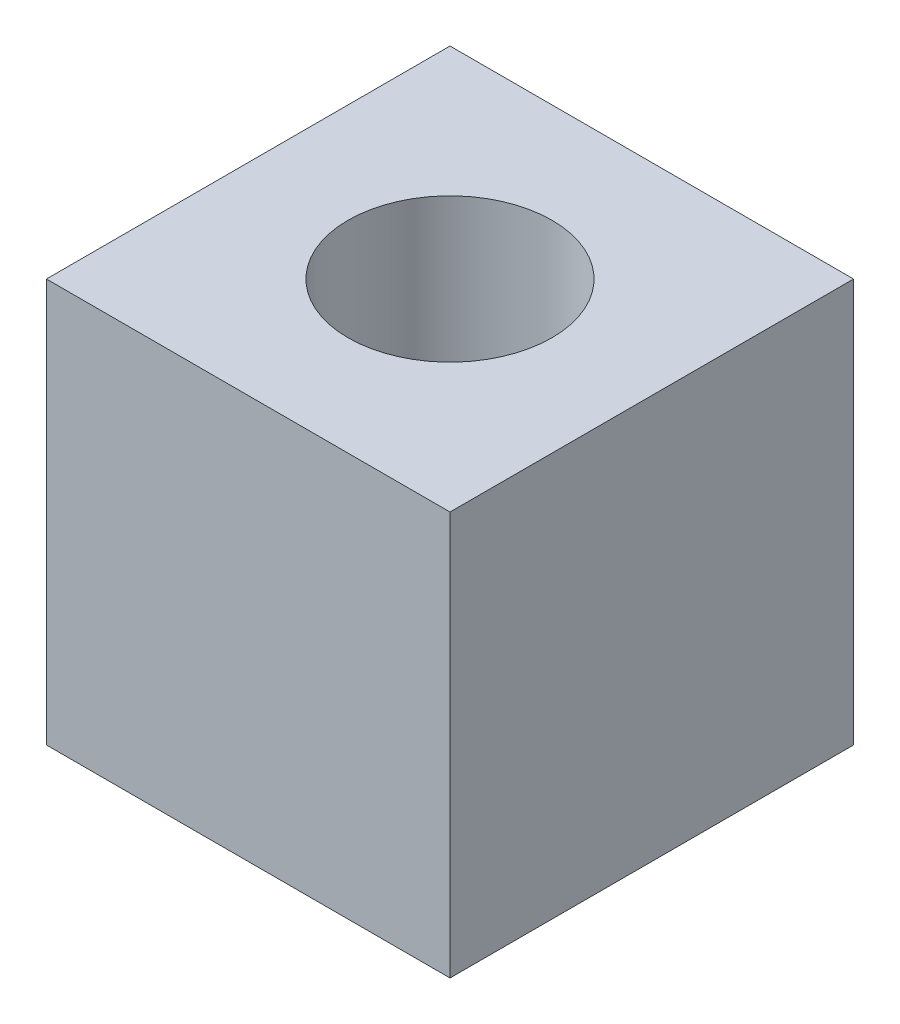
SolidWorks part; units mm, degrees
ref_plane "Front Plane" through (0, 0, 0) normal (0, 0, 1) x (1, 0, 0)
ref_plane "Top Plane" through (0, 0, 0) normal (0, 1, 0) x (1, 0, 0)
ref_plane "Right Plane" through (0, 0, 0) normal (1, 0, 0) x (0, 0, -1)
sketch "Sketch1" plane through (0, 0, 0) normal (0, 1, 0) x (1, 0, 0)
  line L5 (-25.4, -25.4) -> (25.4, -25.4)
  line L6 (-25.4, -25.4) -> (-25.4, 25.4)
  line L7 (-25.4, 25.4) -> (25.4, 25.4)
  line L8 (25.4, -25.4) -> (25.4, 25.4)
  line L9 (-25.4, -25.4) -> (25.4, 25.4) construction
  line L10 (-25.4, 25.4) -> (25.4, -25.4) construction
  circle A0 centre (0, 0) radius 12.827
  dimension "D1" = 25.654
  dimension "D2" = 50.8
  dimension "D3" = 50.8
extrude "Boss-Extrude1" add sketch "Sketch1" along normal blind 50.8
